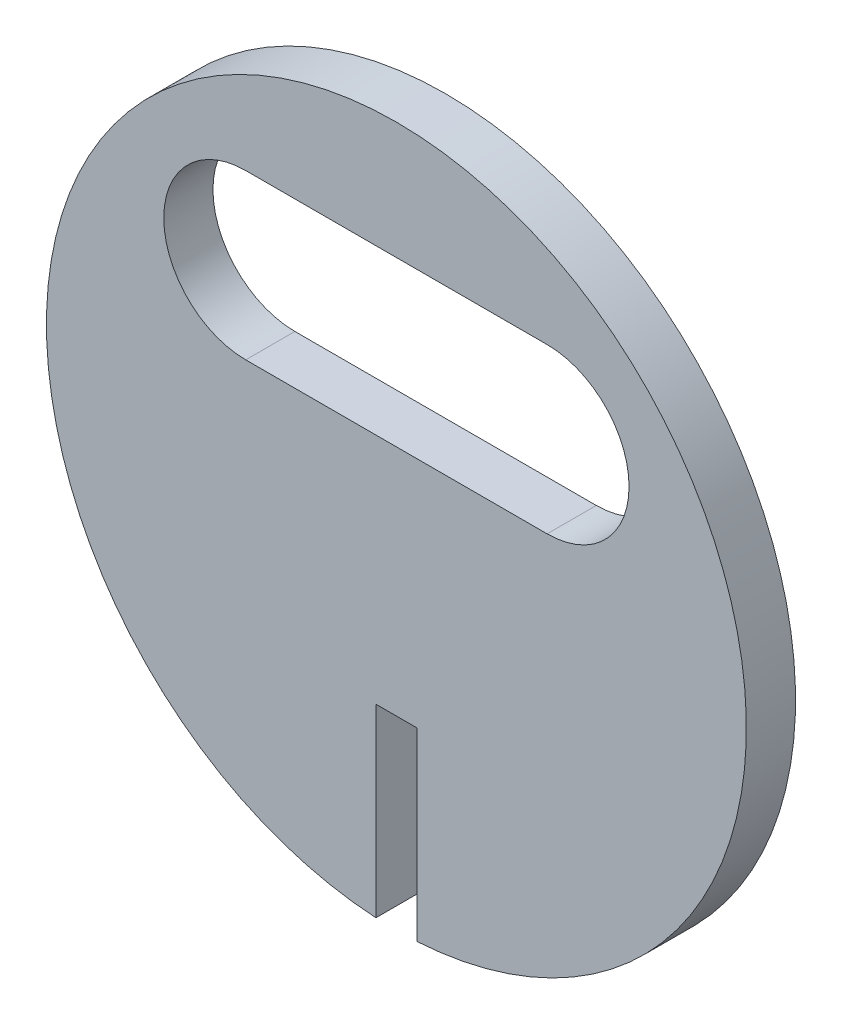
SolidWorks part; units mm, degrees
ref_plane "Front Plane" through (0, 0, 0) normal (0, 0, 1) x (1, 0, 0)
ref_plane "Top Plane" through (0, 0, 0) normal (0, 1, 0) x (1, 0, 0)
ref_plane "Right Plane" through (0, 0, 0) normal (1, 0, 0) x (0, 0, -1)
sketch "Sketch1" plane through (0, 0, 0) normal (0, 0, 1) x (1, 0, 0)
  circle A0 centre (0, 0) radius 27.1145
  dimension "D1" = 54.229
extrude "Extrude1" add sketch "Sketch1" along normal blind 3.81
sketch "Sketch2" plane through (0, 0, 0) normal (0, 0, 1) x (1, 0, 0)
  line L0 (0, 27.1145) -> (0, -27.1145) construction
  line L1 (-11.6743, 18.0243) -> (11.6743, 18.0243)
  line L2 (11.6743, 5.3243) -> (-11.6743, 5.3243)
  line L3 (-11.6743, 11.6743) -> (0, 0) construction
  line L4 (-1.5875, -12.7381) -> (1.5875, -12.7381)
  line L5 (-1.5875, -12.7381) -> (-1.5875, -29.8354)
  line L6 (1.5875, -12.7381) -> (1.5875, -29.8354)
  line L7 (1.5875, -29.8354) -> (-1.5875, -29.8354)
  circle A0 centre (0, 0) radius 27.1145 construction
  arc A1 (-11.6743, 5.3243) -> (-18.0243, 11.6743) centre (-11.6743, 11.6743) cw
  arc A2 (-11.6743, 18.0243) -> (-18.0243, 11.6743) centre (-11.6743, 11.6743) ccw
  arc A3 (11.6743, 5.3243) -> (18.0243, 11.6743) centre (11.6743, 11.6743) ccw
  arc A4 (11.6743, 18.0243) -> (18.0243, 11.6743) centre (11.6743, 11.6743) cw
  point P18 (0, 5.3243)
  point P21 (0, 18.0243)
  dimension "D3" = 45
  dimension "D2" = 12.7
  dimension "D1" = 16.51
  dimension "D4" = 3.175
  dimension "D5" = 1.5875
  dimension "D6" = 14.3764
extrude "Cut-Extrude1" cut sketch "Sketch2" along normal through all
